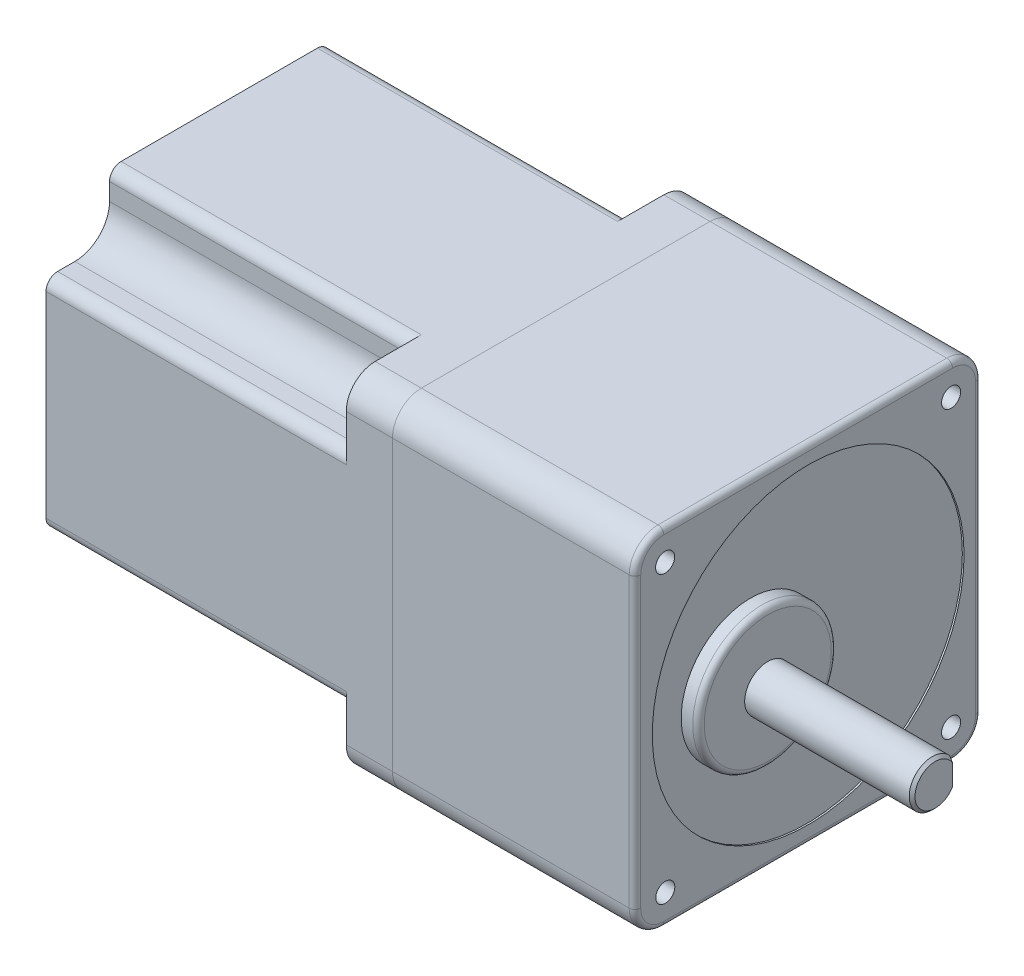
SolidWorks part; units mm, degrees
ref_plane "前视基准面" through (0, 0, 0) normal (0, 0, 1) x (1, 0, 0)
ref_plane "上视基准面" through (0, 0, 0) normal (0, 1, 0) x (1, 0, 0)
ref_plane "右视基准面" through (0, 0, 0) normal (1, 0, 0) x (0, 0, -1)
sketch "草图1" plane through (0, 0, 0) normal (1, 0, 0) x (0, 0, -1)
  line L1 (-25, -30) -> (25, -30)
  line L2 (-30, -25) -> (-30, 25)
  line L3 (-25, 30) -> (25, 30)
  line L4 (30, -25) -> (30, 25)
  line L5 (-30, -30) -> (30, 30) construction
  line L6 (-30, 30) -> (30, -30) construction
  arc A0 (-25, -30) -> (-30, -25) centre (-25, -25) cw
  arc A1 (25, -30) -> (30, -25) centre (25, -25) ccw
  arc A2 (25, 30) -> (30, 25) centre (25, 25) cw
  arc A3 (-30, 25) -> (-25, 30) centre (-25, 25) cw
  point P0 (0, 0)
  dimension "D1" = 5
extrude "凸台-拉伸1" add sketch "草图1" against normal blind 8
sketch "草图3" plane through (0, 0, 0) normal (1, 0, 0) x (0, 0, -1)
  circle A5 centre (-24.7487, 24.7487) radius 3
  circle A6 centre (24.7487, 24.7487) radius 3
  circle A7 centre (24.7487, -24.7487) radius 3
  circle A8 centre (-24.7487, -24.7487) radius 3
extrude "切除-拉伸1" cut sketch "草图3" against normal blind 8
sketch "草图4" plane through (-8, 0, 0) normal (-1, 0, 0) x (0, 0, 1)
  line L0 (-25, 19) -> (-28, 19)
  line L1 (-30, -25) -> (-30, 25) construction
  line L2 (-30, 17) -> (-30, -17)
  line L3 (-25, -19) -> (-28, -19)
  line L4 (-17, -30) -> (17, -30)
  line L5 (-19, -25) -> (-19, -28)
  line L6 (25, -30) -> (-25, -30) construction
  line L7 (30, -17) -> (30, 17)
  line L8 (19, -25) -> (19, -28)
  line L9 (-17, 30) -> (17, 30)
  line L10 (25, -19) -> (28, -19)
  line L11 (30, 25) -> (30, -25) construction
  line L13 (25, 19) -> (28, 19)
  line L15 (19, 25) -> (19, 28)
  line L16 (-25, 30) -> (25, 30) construction
  line L18 (-19, 25) -> (-19, 28)
  arc A0 (-25, 19) -> (-19, 25) centre (-25, 25) ccw
  arc A1 (19, 25) -> (25, 19) centre (25, 25) ccw
  arc A2 (-19, -25) -> (-25, -19) centre (-25, -25) ccw
  arc A3 (25, -19) -> (19, -25) centre (25, -25) ccw
  arc A4 (-19, 28) -> (-17, 30) centre (-17, 28) cw
  arc A5 (19, 28) -> (17, 30) centre (17, 28) ccw
  arc A6 (28, 19) -> (30, 17) centre (28, 17) cw
  arc A7 (28, -19) -> (30, -17) centre (28, -17) ccw
  arc A8 (19, -28) -> (17, -30) centre (17, -28) cw
  arc A9 (-19, -28) -> (-17, -30) centre (-17, -28) ccw
  arc A10 (-28, -19) -> (-30, -17) centre (-28, -17) cw
  arc A11 (-30, 17) -> (-28, 19) centre (-28, 17) cw
  point P7 (-19, 30)
  point P37 (19, 30)
  point P40 (30, 19)
  point P43 (30, -19)
  point P46 (19, -30)
  point P49 (-19, -30)
  point P52 (-30, -19)
  point P55 (-30, 19)
  dimension "D1" = 2
extrude "凸台-拉伸2" add sketch "草图4" along normal blind 52
sketch "草图5" plane through (0, 0, 0) normal (1, 0, 0) x (0, 0, -1)
  line L0 (25, 30) -> (-25, 30) construction
  line L1 (-25, -30) -> (25, -30)
  line L2 (-30, -25) -> (-30, 25)
  line L3 (-25, 30) -> (25, 30)
  line L4 (30, -25) -> (30, 25)
  line L5 (-30, -30) -> (30, 30) construction
  line L6 (-30, 30) -> (30, -30) construction
  arc A0 (-25, -30) -> (-30, -25) centre (-25, -25) cw
  arc A1 (25, -30) -> (30, -25) centre (25, -25) ccw
  arc A2 (25, 30) -> (30, 25) centre (25, 25) cw
  arc A3 (-30, 25) -> (-25, 30) centre (-25, 25) cw
  point P0 (0, 0)
  dimension "D1" = 5
extrude "凸台-拉伸3" add sketch "草图5" along normal blind 42 separate body
sketch "草图6" plane through (42, 0, 0) normal (1, 0, 0) x (0, 0, -1)
  point P19 (-24.7793, 24.7793)
  point P20 (24.7487, 24.7487)
  point P21 (24.7487, -24.7487)
  point P22 (-24.7487, -24.7487)
hole_wizard "M4 螺纹孔1" positions "3D草图1" profile "草图7" tap size "M4" standard "GB"
sketch3d "3D草图1"
  point P0 (42, 24.7793, 24.7793)
  point P3 (42, 24.7487, -24.7487)
  point P6 (42, -24.7487, -24.7487)
  point P9 (42, -24.7487, 24.7487)
sketch "草图7" plane through (42, 24.7793, 24.7793) normal (0, 1, 0) x (0, 0, -1)
  line L0 (0, 0) -> (0, 12.9914)
  line L1 (0, 12.9914) -> (1.65, 12)
  line L2 (1.65, 12) -> (1.65, 0)
  line L5 (1.65, 0) -> (0, 0)
  line L10 (0, 12.9914) -> (-1.65, 12) construction
  line L11 (0, -6.35) -> (0, 107.95) construction
  dimension "螺纹孔钻头直径" = 3.3
  dimension "螺纹孔钻头深度" = 12
  dimension "导头角度" = 118
sketch "草图8" plane through (0, 0, 0) normal (-1, 0, 0) x (0, 0, 1)
  circle A0 centre (-24.7487, 24.7487) radius 3
  circle A1 centre (24.7487, 24.7487) radius 3
  circle A2 centre (24.7487, -24.7487) radius 3
  circle A3 centre (-24.7487, -24.7487) radius 3
extrude "切除-拉伸2" cut sketch "草图8" against normal blind 30
sketch "草图9" plane through (42, 0, 0) normal (1, 0, 0) x (0, 0, -1)
  circle A0 centre (-10, 0) radius 12
extrude "凸台-拉伸4" add sketch "草图9" along normal blind 3
fillet "圆角1" radius 1 1 edges at (45, 0, -2)
sketch "草图10" plane through (45, 0, 0) normal (1, 0, 0) x (0, 0, -1)
  circle A0 centre (-10, 0) radius 4
extrude "凸台-拉伸5" add sketch "草图10" along normal blind 29
sketch "草图11" plane through (74, 0, 0) normal (1, 0, 0) x (0, 0, -1)
  line L2 (-7, 2.6458) -> (-7, -2.6458)
  arc A0 (-7, -2.6458) -> (-7, 2.6458) centre (-10, 0) ccw
extrude "切除-拉伸3" cut sketch "草图11" against normal blind 25
chamfer "倒角1" distance 0.5 angle 45 1 edges at (74, 0, 14)
sketch "草图12" plane through (42, 0, 0) normal (1, 0, 0) x (0, 0, -1)
  circle A0 centre (0, 0) radius 27
extrude "切除-拉伸4" cut sketch "草图12" against normal blind 0.3
fillet "圆角2" radius 1 8 edges at (42, -28.5355, 28.5355) (42, -30, 0) (42, -28.5355, -28.5355) (42, 0, -30) (42, 28.5355, -28.5355) (42, 0, 30) (42, 28.5355, 28.5355) (42, 30, 0)
